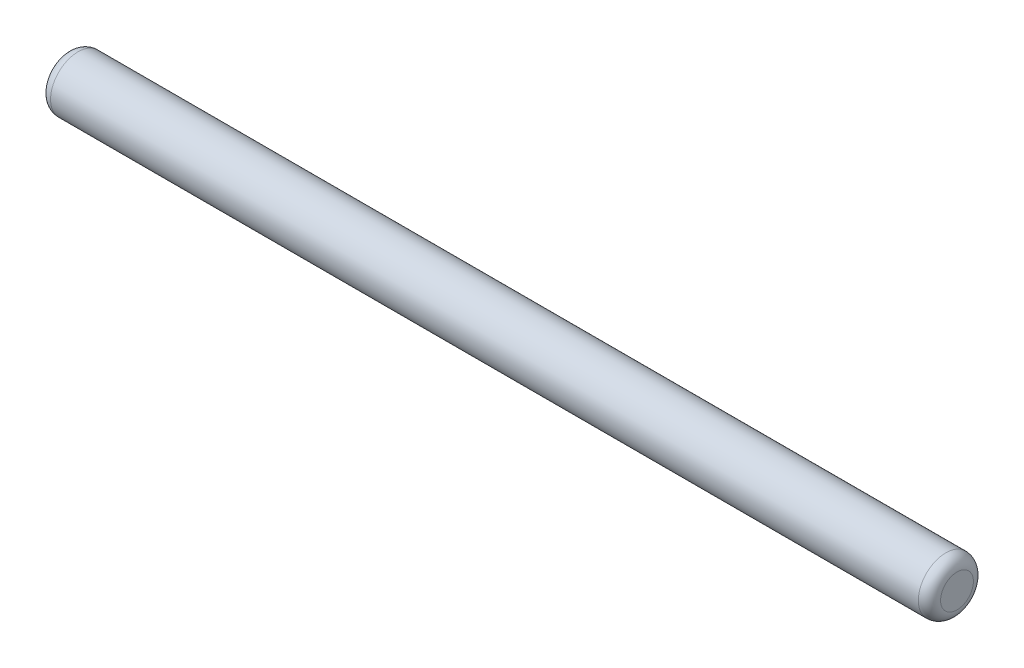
SolidWorks part; units mm, degrees
ref_plane "Front Plane" through (0, 0, 0) normal (0, 0, 1) x (1, 0, 0)
ref_plane "Top Plane" through (0, 0, 0) normal (0, 1, 0) x (1, 0, 0)
ref_plane "Right Plane" through (0, 0, 0) normal (1, 0, 0) x (0, 0, -1)
sketch "Sketch1" plane through (0, 0, 0) normal (1, 0, 0) x (0, 0, -1)
  circle A0 centre (0, 0) radius 6.2865
  dimension "D1" = 12.573
extrude "Boss-Extrude1" add sketch "Sketch1" along normal mid plane 203.2
fillet "Fillet1" radius 2.54 2 edges at (-101.6, 0, -6.2865) (101.6, 0, -6.2865)
